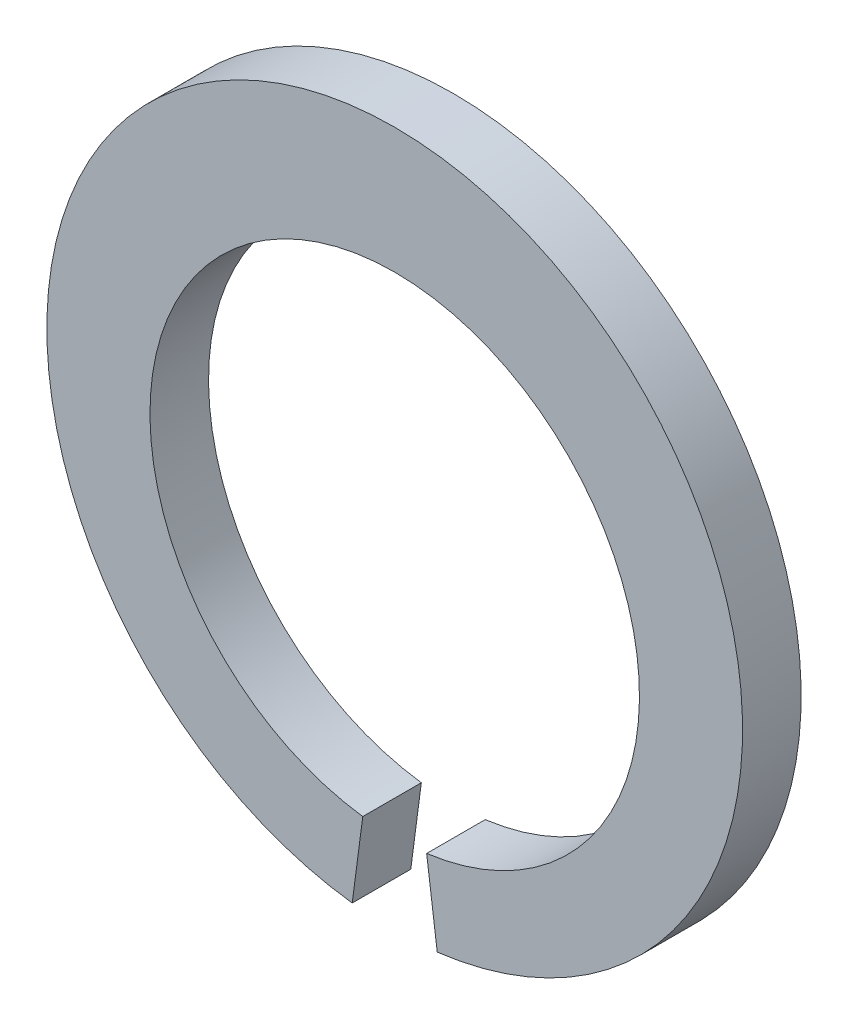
SolidWorks part; units mm, degrees
ref_plane "Plane1" through (0, 0, 0) normal (0, 0, 1) x (1, 0, 0)
ref_plane "Plane2" through (0, 0, 0) normal (0, 1, 0) x (1, 0, 0)
ref_plane "Plane3" through (0, 0, 0) normal (1, 0, 0) x (0, 0, -1)
extrude "Body" add sketch "BodySke" against normal blind 1.0668
sketch "BodySke" plane through (0, 0, 0) normal (0, 0, 1) x (1, 0, 0)
  line L0 (-1.5431, 0) -> (1.5431, 0) construction
  line L1 (0, 0) -> (0, 6.7437) construction
  line L2 (0.5818, -4.4196) -> (0.7741, -5.8802)
  line L3 (-0.5818, -4.4196) -> (-0.7741, -5.8802)
  line L4 (0, 0) -> (0.5818, -4.4196) construction
  line L5 (0, 0) -> (-0.5818, -4.4196) construction
  arc A2 (0.7741, -5.8802) -> (-0.7741, -5.8802) centre (0, 0.408) ccw construction
  arc A3 (0.5818, -4.4196) -> (-0.5818, -4.4196) centre (0, 0) ccw
  arc A7 (0.7741, -5.8802) -> (-0.7741, -5.8802) centre (0, 0.408) ccw
  dimension "GrooveDia" = 8.9154
  dimension "LargeRad" = 6.7437
  dimension "SmallRad" = 5.9309
  dimension "GapAngle" = 15
sketch "Clipboard" plane through (0, 0, 0) normal (0, 0, 1) x (1, 0, 0)
  line L0 (0, 0) -> (2.286, 0)
  line L1 (0, 0) -> (0, 1.4732)
  circle A1 centre (0, 0) radius 4.7625
  dimension "ShaftDia" = 9.525
  dimension "LargeSection" = 2.286
  dimension "SmallSection" = 1.4732
equation "' \"ShaftDia@Clipboard\" = 0.101"
equation "' \"Thickness@Body\" = 0.02"
equation "' \"GrooveDia@BodySke\" = 0.093"
equation "' \"LargeSection@Clipboard\" = 0.027"
equation "' \"SmallSection@Clipboard\" = 0.017"
equation "' \"ShaftDia@Clipboard\" = 0.375"
equation "' \"Thickness@Body\" = 0.042"
equation "' \"GrooveDia@BodySke\" = 0.351"
equation "' \"LargeSection@Clipboard\" = 0.09"
equation "' \"SmallSection@Clipboard\" = 0.058"
equation "\"LargeRad@BodySke\" =  \"GrooveDia@BodySke\" / 2 +  \"LargeSection@Clipboard\""
equation "\"SmallRad@BodySke\" =  \"GrooveDia@BodySke\" / 2 +  \"SmallSection@Clipboard\""
